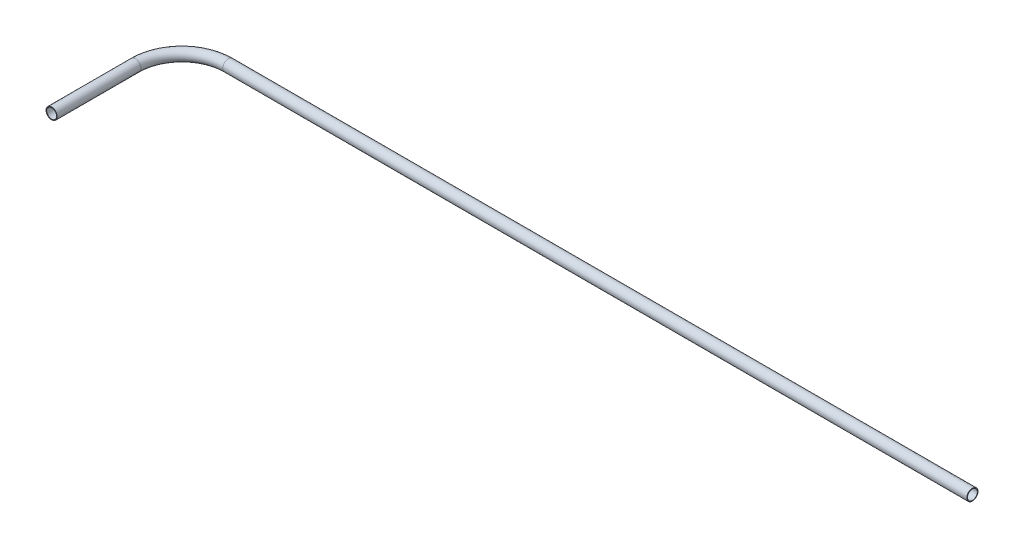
SolidWorks part; units mm, degrees
ref_plane "Ebene vorne" through (0, 0, 0) normal (0, 0, 1) x (1, 0, 0)
ref_plane "Ebene oben" through (0, 0, 0) normal (0, 1, 0) x (1, 0, 0)
ref_plane "Ebene rechts" through (0, 0, 0) normal (1, 0, 0) x (0, 0, -1)
sketch "Skizze1" plane through (0, 0, 0) normal (0, 1, 0) x (1, 0, 0)
  line L0 (0, 0) -> (0, 450)
  line L1 (250, 700) -> (4250, 700)
  arc A0 (250, 700) -> (0, 450) centre (250, 450) ccw
  dimension "D1" = 250
  dimension "D2" = 450
  dimension "D3" = 4000
other "Strukturbauteil1"
ref_plane "Ebene1" through (0, 0, 0) normal (0, 0, -1) x (-1, 0, 0)
sketch "Sketch1" plane through (0, 0, 0) normal (0, 0, -1) x (-1, 0, 0)
  circle A0 centre (0, 0) radius 30.15
  circle A1 centre (0, 0) radius 26.5
  point P3 (0, 0)
  dimension "In_dia" = 60.3
  dimension "Out_dia" = 53
